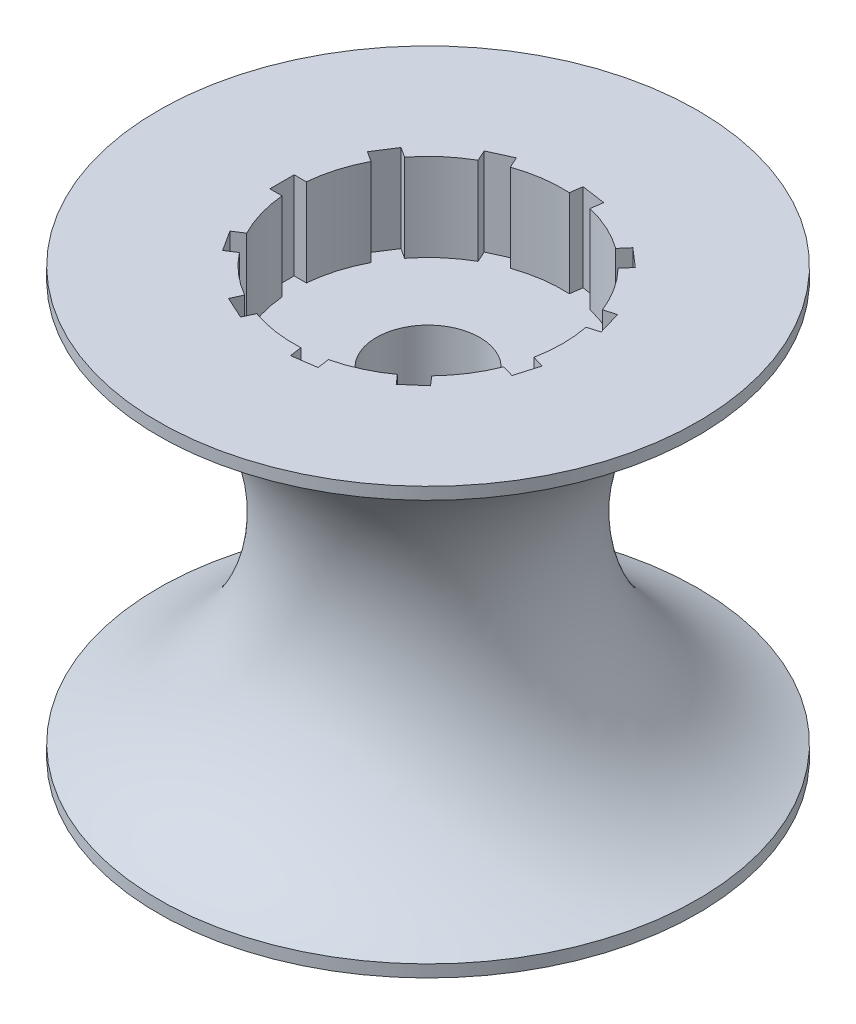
SolidWorks part; units mm, degrees
ref_plane "Plan de face" through (0, 0, 0) normal (0, 0, 1) x (1, 0, 0)
ref_plane "Plan de dessus" through (0, 0, 0) normal (0, 1, 0) x (1, 0, 0)
ref_plane "Plan de droite" through (0, 0, 0) normal (1, 0, 0) x (0, 0, -1)
sketch "Esquisse1" plane through (0, 0, 0) normal (1, 0, 0) x (0, 0, -1)
  line L0 (0, 0) -> (0, 35) construction
  line L3 (0, 0) -> (-22.169, 0)
  line L4 (0, 0) -> (0, 17.5)
  line L6 (-22.169, 1) -> (-22.169, 0)
  line L7 (-10.5, 17.5) -> (0, 17.5)
  arc A1 (-10.5, 17.5) -> (-22.169, 1) centre (-28, 17.5) cw
  dimension "D1" = 17.5
  dimension "D2" = 22.169
  dimension "D3" = 1
  dimension "D4" = 17.5
  dimension "D5" = 10.5
revolve "Révolution1" add sketch "Esquisse1" angle 360 about L0
sketch "Esquisse2" plane through (0, 0, 0) normal (0, -1, 0) x (1, 0, 0)
  circle A0 centre (0, 0) radius 4.25
  dimension "D1" = 8.5
extrude "Enlèv. mat.-Extru.1" cut sketch "Esquisse2" against normal blind 87
sketch "Esquisse3" plane through (0, 0, 0) normal (0, -1, 0) x (-1, 0, 0)
  circle A0 centre (0, 0) radius 11.05
  dimension "D1" = 22.1
extrude "Enlèv. mat.-Extru.2" cut sketch "Esquisse3" against normal blind 7.2
sketch "Esquisse6" plane through (0, 0, 0) normal (0, -1, 0) x (1, 0, 0)
  line L0 (-11.05, 0) -> (-12.0047, 0) construction
  line L1 (-11.0047, -1) -> (-12.0047, -1)
  line L2 (-12.0047, -1) -> (-12.0047, 1)
  line L3 (-12.0047, 1) -> (-11.0047, 1)
  line L4 (-11.0047, -1) -> (-11.0047, 1)
  circle A0 centre (0, 0) radius 11.05 construction
  circle A1 centre (0, 0) radius 11.05 construction
  dimension "D1" = 1
  dimension "D2" = 2
extrude "Enlèv. mat.-Extru.5" cut sketch "Esquisse6" against normal up to surface (7.2 mm away)
pattern_circular "Répétition circulaire1" count 11 over 360 about axis through (0, 0, 0) along (0, 1, 0) of "Enlèv. mat.-Extru.5"
mirror "Symétrie1" about plane through (0, 17.5, 10.5) normal (0, -1, 0)
